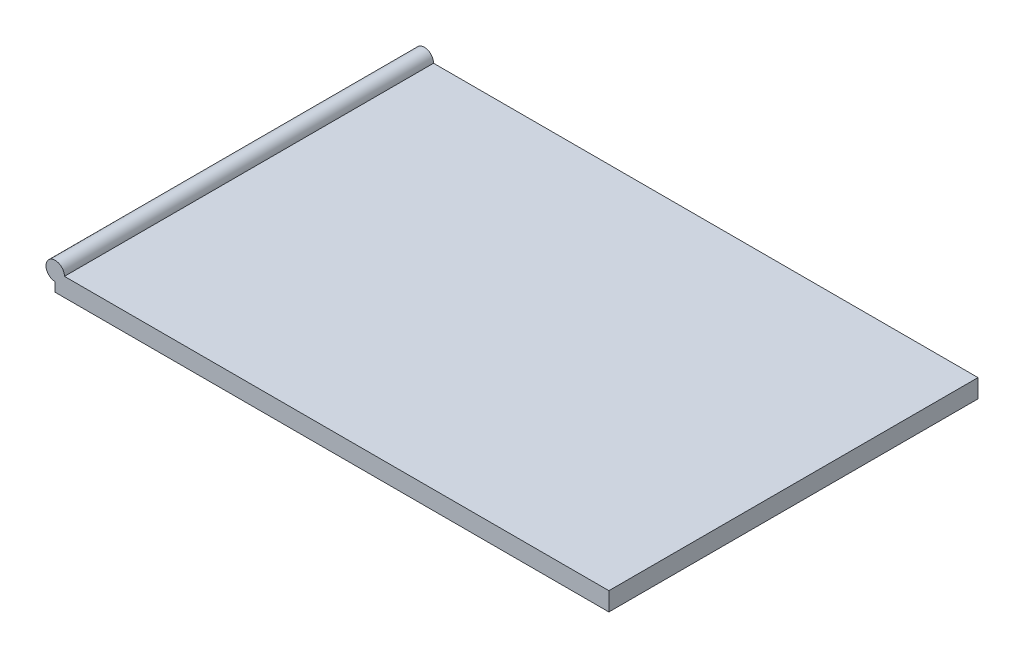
SolidWorks part; units mm, degrees
ref_plane "Plan de face" through (0, 0, 0) normal (0, 0, 1) x (1, 0, 0)
ref_plane "Plan de dessus" through (0, 0, 0) normal (0, 1, 0) x (1, 0, 0)
ref_plane "Plan de droite" through (0, 0, 0) normal (1, 0, 0) x (0, 0, -1)
sketch "Esquisse1" plane through (0, 0, 0) normal (0, 0, 1) x (1, 0, 0)
  line L1 (0, 0) -> (150, 0)
  line L2 (0, 0) -> (0, -5)
  line L3 (0, -5) -> (150, -5)
  line L4 (150, 0) -> (150, -5)
  dimension "D1" = 5
  dimension "D2" = 150
extrude "Boss.-Extru.1" add sketch "Esquisse1" along normal mid plane 100
sketch "Esquisse2" plane through (0, 0, 50) normal (0, 0, 1) x (1, 0, 0)
  circle A0 centre (0, 0) radius 2.5
  dimension "D1" = 5
extrude "Boss.-Extru.2" add sketch "Esquisse2" against normal up to surface (100 mm away)
